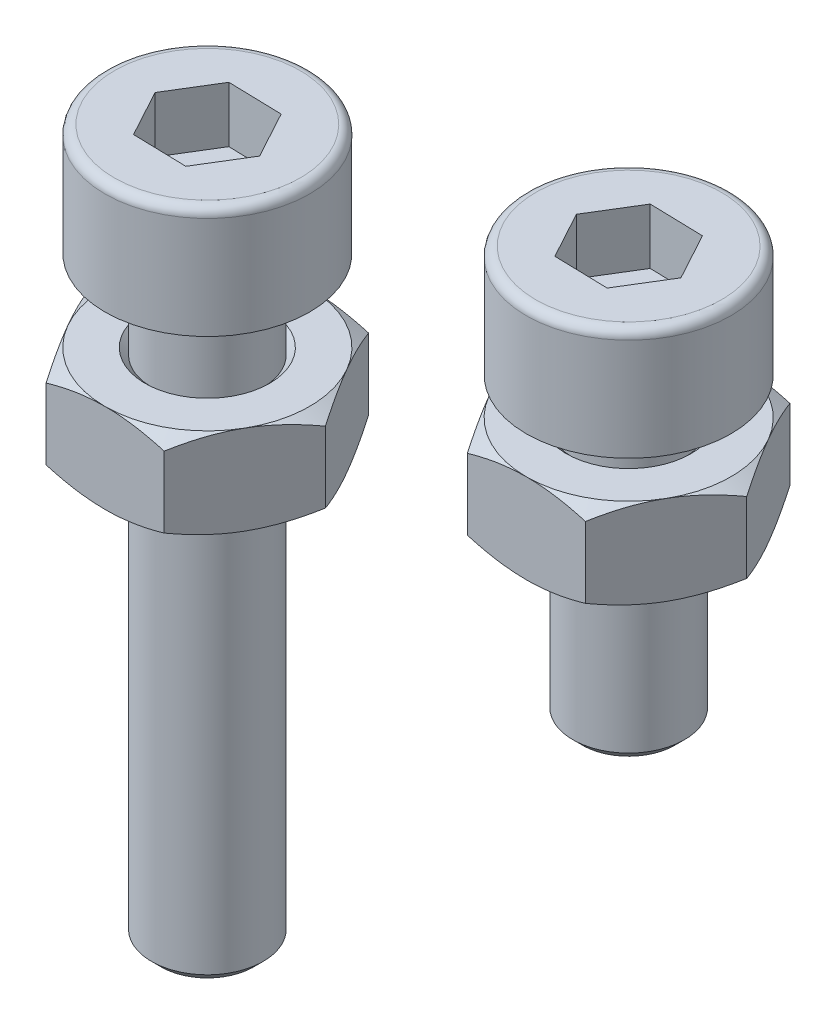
SolidWorks part; units mm, degrees
other "<M3X16>-<CHANFREIN>"
other "<CHC>-<CHANFREIN>"
other "<M3 Nut>-<Kes-Süpür1>"
ref_plane "Front Plane" through (0, 0, 0) normal (0, 0, 1) x (1, 0, 0)
ref_plane "Top Plane" through (0, 0, 0) normal (0, 1, 0) x (1, 0, 0)
ref_plane "Right Plane" through (0, 0, 0) normal (1, 0, 0) x (0, 0, -1)
inserted part "CHC"
inserted part "M3 Nut"
move or copy body "Body-Move/Copy2" placed by mates yes
other "Distance1" parameters "D1"=1
inserted part "M3X16"
move or copy body "Body-Move/Copy4"
move or copy body "Body-Move/Copy5" bodies to move or copy 102 placed by mates yes
move or copy body "Body-Move/Copy6" bodies to move or copy 104 copy yes number of copies 1 translate (10, 0, 0)
move or copy body "Body-Move/Copy7" bodies to move or copy 105 placed by mates yes
